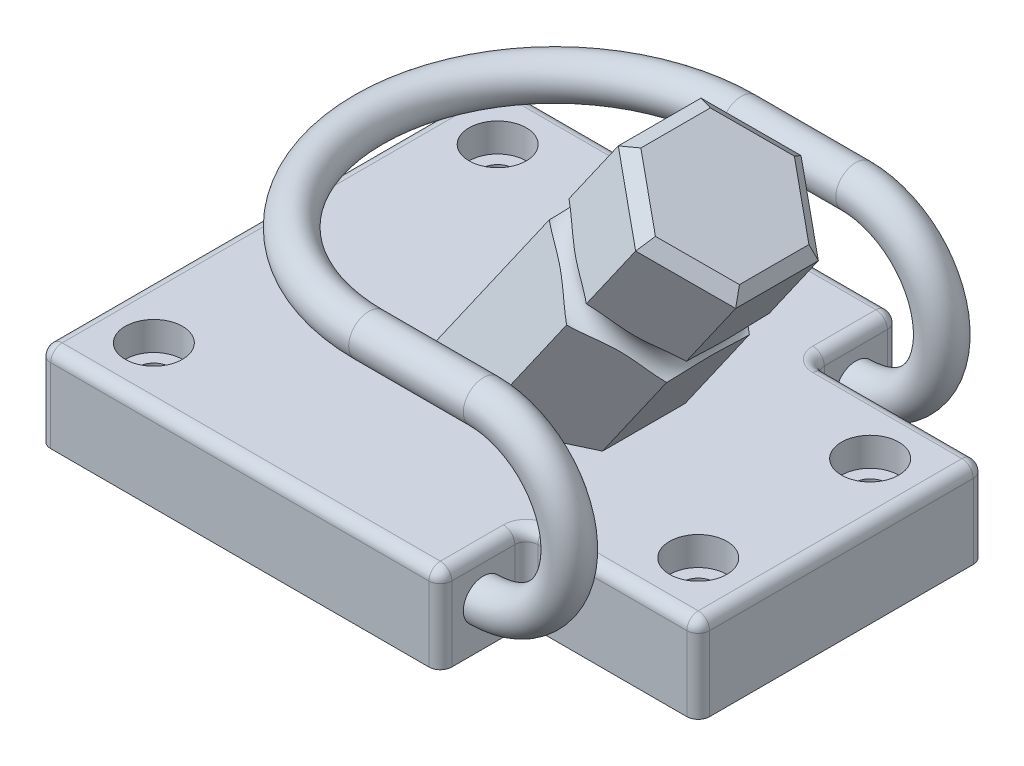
SolidWorks part; units mm, degrees
ref_plane "Front Plane" through (0, 0, 0) normal (0, 0, 1) x (1, 0, 0)
ref_plane "Top Plane" through (0, 0, 0) normal (0, 1, 0) x (1, 0, 0)
ref_plane "Right Plane" through (0, 0, 0) normal (1, 0, 0) x (0, 0, -1)
sketch "Sketch1" plane through (0, 0, 0) normal (0, 1, 0) x (1, 0, 0)
  line L0 (35, 25) -> (35, 40)
  line L1 (-35, -40) -> (35, -40)
  line L2 (-35, -40) -> (-35, 40)
  line L3 (-35, 40) -> (35, 40)
  line L4 (35, -40) -> (35, -25)
  line L5 (-35, -40) -> (35, 40) construction
  line L6 (-35, 40) -> (35, -40) construction
  line L7 (65, -25) -> (35, -25)
  line L8 (65, -25) -> (65, 25)
  line L9 (65, 25) -> (35, 25)
  line L11 (65, -25) -> (35, 25) construction
  line L12 (65, 25) -> (35, -25) construction
  point P0 (0, 0)
  point P6 (50, 0)
  dimension "D1" = 80
  dimension "D2" = 70
  dimension "D3" = 50
  dimension "D4" = 30
extrude "Boss-Extrude1" add sketch "Sketch1" along normal blind 15
sketch "Sketch4" plane through (0, 15, 0) normal (0, 1, 0) x (1, 0, 0)
  line L0 (0, 25) -> (0, -25) construction
  line L1 (65, 25) -> (35, 25) construction
  line L2 (35, -25) -> (65, -25) construction
  line L3 (65, -25) -> (65, 25) construction
  dimension "D1" = 65
ref_plane "Plane2" through (7.0477, 10.0652, 0) normal (0.5736, 0.8192, 0) x (0, 0, 1)
sketch "Sketch5" plane through (7.0477, 10.0652, 0) normal (0.5736, 0.8192, 0) x (0, 0, 1)
  line L0 (-25, -8.6036) -> (25, -8.6036) construction
  line L1 (7.2169, -8.6036) -> (14.4338, 3.8964)
  line L2 (14.4338, 3.8964) -> (7.2169, 16.3964)
  line L3 (7.2169, 16.3964) -> (-7.2169, 16.3964)
  line L4 (-7.2169, 16.3964) -> (-14.4338, 3.8964)
  line L5 (-14.4338, 3.8964) -> (-7.2169, -8.6036)
  line L6 (-7.2169, -8.6036) -> (7.2169, -8.6036)
  circle A0 centre (0, 3.8964) radius 12.5 construction
  dimension "D1" = 25
extrude "Boss-Extrude3" add sketch "Sketch5" along normal blind 60
sketch "Sketch6" plane through (0, 0, 0) normal (0, 0, 1) x (1, 0, 0)
  line L1 (21.3048, 48.9132) -> (43.4219, 33.4267) construction
  line L2 (54.8934, 49.8097) -> (30.5194, 15) construction
  line L3 (35.3313, 43.6653) -> (71.1329, 94.7952) construction
  line L4 (44.654, 56.9794) -> (15.2597, 15) construction
  line L5 (34.4146, 64.1491) -> (0, 15) construction
  circle A0 centre (21.3048, 48.9132) radius 3
  dimension "D1" = 6
  dimension "D2" = 40
  dimension "D3" = 2
revolve "Cut-Revolve1" cut sketch "Sketch6" angle 360 about L3
chamfer "Chamfer1" distance 2 angle 45 6 edges at (39.5343, 60.5643, -10.8253) (49.7737, 53.3946, -10.8253) (54.8934, 49.8097, 0) (49.7737, 53.3946, 10.8253) (39.5343, 60.5643, 10.8253) (34.4146, 64.1491, 0)
sketch "Sketch10" plane through (35, 0, 0) normal (1, 0, 0) x (0, 0, -1)
  line L0 (-40, 15) -> (-25, 0) construction
  line L1 (-45.1202, 22.5) -> (-20.9067, 22.5) construction
  circle A0 centre (-32.5, 7.5) radius 3.5
  dimension "D1" = 7
  dimension "D2" = 15
revolve "Revolve1" add sketch "Sketch10" angle 180 about L1
sketch "Sketch12" plane through (35, 0, 0) normal (-1, 0, 0) x (0, 0, 1)
  circle A1 centre (32.5, 37.5) radius 3.5
  circle A2 centre (32.5, 37.5) radius 3.5
  dimension "D1" = 0
extrude "Boss-Extrude4" add sketch "Sketch12" along normal blind 20
mirror "Mirror2" about plane through (0, 0, 0) normal (0, 0, 1) of "Boss-Extrude4", "Revolve1"
sketch "Sketch13" plane through (15, 0, 0) normal (-1, 0, 0) x (0, 0, 1)
  line L0 (0, 25.6876) -> (0, 57.0477) construction
  circle A1 centre (-32.5, 37.5) radius 3.5
  circle A2 centre (-32.5, 37.5) radius 3.5
  dimension "D1" = 0
revolve "Revolve2" add sketch "Sketch13" angle 180 about L0
fillet "Fillet2" radius 2 8 edges at (65, 7.5, 25) (65, 7.5, -25) (35, 7.5, 25) (35, 7.5, 40) (-35, 7.5, 40) (-35, 7.5, -40) (35, 7.5, -40) (35, 7.5, -25)
fillet "Fillet3" radius 2 16 edges at (35.5858, 15, 25.5858) (35, 15, 32.5) (34.4142, 15, 39.4142) (0, 15, 40) (-34.4142, 15, 39.4142) (-35, 15, 0) (-34.4142, 15, -39.4142) (0, 15, -40) (34.4142, 15, -39.4142) (35, 15, -32.5) (35.5858, 15, -25.5858) (50, 15, -25) (64.4142, 15, -24.4142) (65, 15, 0) (64.4142, 15, 24.4142) (50, 15, 25)
hole_wizard "CBORE for M5 SHCS1" positions "Sketch14" profile "Sketch15" counterbore size "M5" standard "ANSI Metric"
sketch "Sketch14" plane through (0, 15, 0) normal (0, 1, 0) x (1, 0, 0)
  line L0 (-35, -38) -> (-35, 38) construction
  line L1 (-33, 40) -> (33, 40) construction
  line L2 (65, 23) -> (65, -23) construction
  line L3 (37, 25) -> (63, 25) construction
  point P0 (-25, 30)
  point P2 (55, 15)
  dimension "D1" = 10
  dimension "D2" = 10
  dimension "D3" = 10
  dimension "D4" = 10
sketch "Sketch15" plane through (-25, 15, -30) normal (1, 0, 0) x (0, 0, 1)
  line L0 (0, 0) -> (0, 15)
  line L1 (0, 15) -> (2.75, 15)
  line L3 (2.75, 15) -> (2.75, 5)
  line L4 (2.75, 5) -> (5, 5)
  line L5 (5, 5) -> (5, 0)
  line L7 (5, 0) -> (0, 0)
  line L11 (0, -6.35) -> (0, 107.95) construction
  dimension "Thru Hole Dia." = 5.5
  dimension "Thru Hole Depth" = 15
  dimension "C'Bore Dia." = 10
  dimension "C'Bore Depth" = 5
mirror "Mirror3" about plane through (0, 0, 0) normal (0, 0, 1) of "CBORE for M5 SHCS1"
